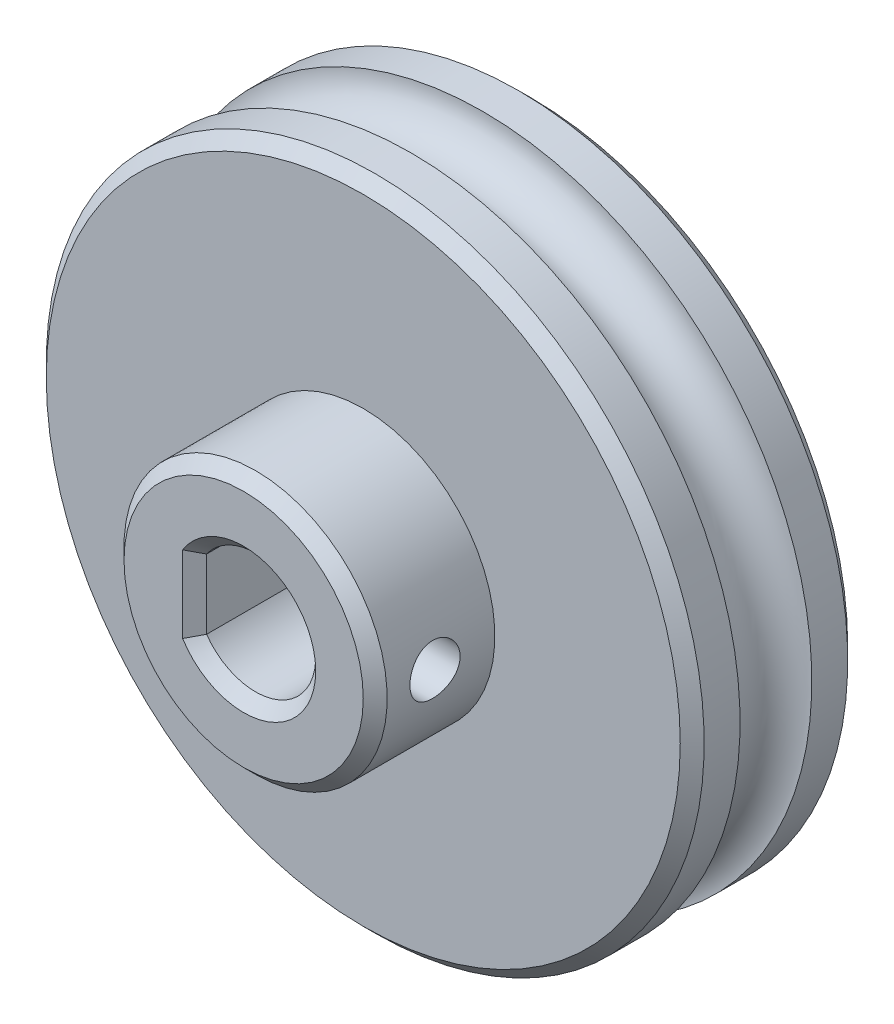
SolidWorks part; units mm, degrees
ref_plane "Top Plane" through (0, 0, 0) normal (0, 0, 1) x (1, 0, 0)
ref_plane "Front Plane" through (0, 0, 0) normal (0, 1, 0) x (1, 0, 0)
ref_plane "Right Plane" through (0, 0, 0) normal (1, 0, 0) x (0, 0, -1)
sketch "Sketch1" plane through (0, 0, 0) normal (1, 0, 0) x (0, 0, -1)
  line L0 (0, 69.2651) -> (0, -69.2651) construction
  line L1 (0, -27.5) -> (-4, -27.5)
  line L5 (-10, -27.5) -> (-14, -27.5)
  line L6 (-14, -27.5) -> (-14, -11)
  line L7 (-14, -11) -> (-24, -11)
  line L8 (-24, -11) -> (-24, 0)
  line L9 (-85.9712, 0) -> (85.9712, 0) construction
  line L10 (-24, 0) -> (0, 0)
  line L11 (0, 0) -> (0, -27.5)
  line L12 (-10, -27.5) -> (-4, -27.5) construction
  arc A1 (-4, -27.5) -> (-10, -27.5) centre (-7, -27.5) ccw
  point P3 (-12.6993, -23.3577)
  point P4 (0, 0)
  point P15 (0, 0)
  point P18 (0, 0)
  dimension "D3" = 4
  dimension "D1" = 10
  dimension "D2" = 6
  dimension "D4" = 4
  dimension "D5" = 22
  dimension "D6" = 55
revolve "Revolve1" add sketch "Sketch1" angle 360 about L9
chamfer "Chamfer1" distance 1 angle 45 3 edges at (0, -11, 24) (0, -27.5, 14) (0, -27.5, 0)
sketch "Sketch2" plane through (0, 0, 24) normal (0, 0, 1) x (1, 0, 0)
  line L0 (-7.6235, 0) -> (7.6235, 0) construction
  line L1 (-4.1, 2.9053) -> (-4.1, -2.9053)
  arc A0 (-4.1, -2.9053) -> (-4.1, 2.9053) centre (0, 0) ccw
  point P6 (0, 0)
  point P9 (-4.1, 0)
  dimension "D1" = 10.05
  dimension "D2" = 4.1
extrude "Cut-Extrude1" cut sketch "Sketch2" against normal through all
chamfer "Chamfer2" distance 1 angle 45 4 edges at (-4.1, 0, 0) (5.025, 0, 0) (-4.1, 0, 24) (5.025, 0, 24)
sketch "Sketch3" plane through (-4.1, 0, 0) normal (1, 0, 0) x (0, 0, -1)
  line L0 (-23, 0) -> (-19, 0) construction
  line L1 (-23, 2.9053) -> (-23, -2.9053) construction
  circle A0 centre (-19, 0) radius 2.1
  dimension "D2" = 4.2
  dimension "D1" = 4
extrude "Cut-Extrude2" cut sketch "Sketch3" along normal up to surface (15.1 mm away)
